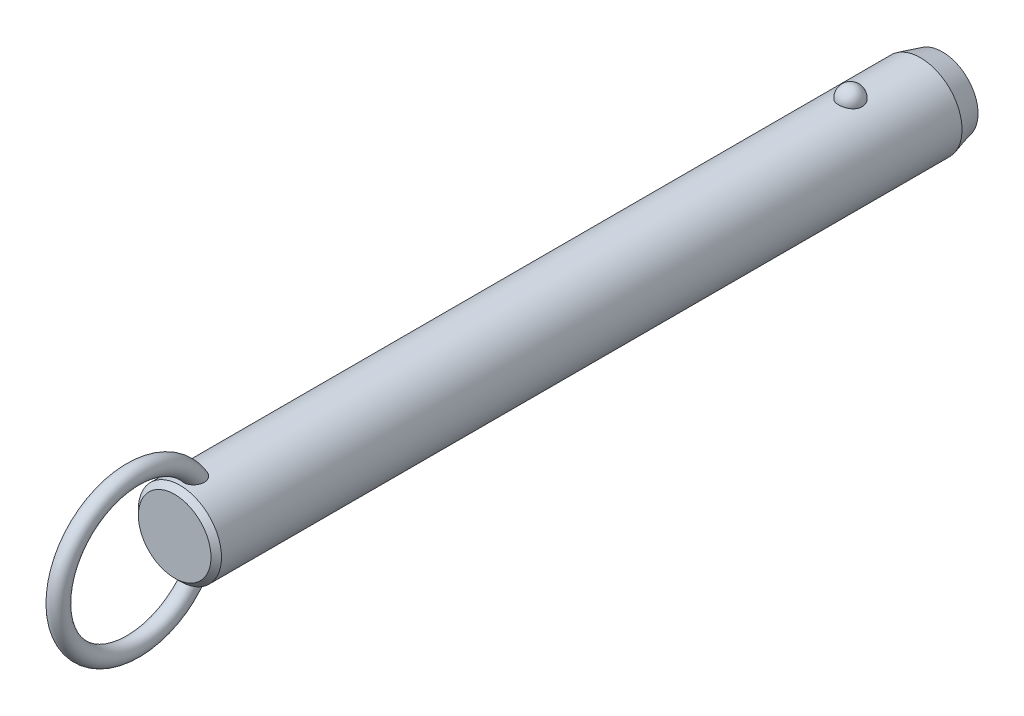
SolidWorks part; units mm, degrees
ref_plane "Front Plane" through (0, 0, 0) normal (0, 0, 1) x (1, 0, 0)
ref_plane "Top Plane" through (0, 0, 0) normal (0, 1, 0) x (1, 0, 0)
ref_plane "Right Plane" through (0, 0, 0) normal (1, 0, 0) x (0, 0, -1)
sketch "Sketch2" plane through (0, 0, 0) normal (0, 0, 1) x (1, 0, 0)
  circle A0 centre (0, 0) radius 9.5
  point P3 (0, 9.5)
  dimension "D1" = 19
extrude "Boss-Extrude1" add sketch "Sketch2" along normal blind 142.2
sketch "Sketch3" plane through (0, 0, 0) normal (0, 0, -1) x (-1, 0, 0)
  circle A0 centre (0, 0) radius 9.5
  dimension "D1" = 19
extrude "Boss-Extrude2" add sketch "Sketch3" along normal blind 23.7
chamfer "Chamfer1" distance 5 angle 15 1 edges at (-9.5, 0, -23.7)
sketch "Sketch12" plane through (0, 0, 0) normal (1, 0, 0) x (0, 0, -1)
  line L0 (-142.2, 9.5) -> (-142.2, -9.5) construction
  point P0 (-142.2, 0)
sketch "Sketch13" plane through (0, 0, 0) normal (1, 0, 0) x (0, 0, -1)
  circle A0 centre (-161.25, 0) radius 19.05
  point P2 (-142.2, 0)
  dimension "D1" = 38.1
sketch "Sketch14" plane through (0, 0, 0) normal (0, 1, 0) x (1, 0, 0)
  circle A0 centre (0, -144.2) radius 2
  point P2 (0, -142.2)
  dimension "D1" = 4
sweep "Sweep1" add profiles "Sketch14" path "Sketch13"
sketch "Sketch15" plane through (0, 0, 142.2) normal (0, 0, 1) x (1, 0, 0)
  circle A0 centre (0, 0) radius 9.5
  dimension "D1" = 19
extrude "Boss-Extrude3" add sketch "Sketch15" along normal blind 9.52
chamfer "Chamfer2" distance 1.2 angle 45 1 edges at (9.5, 0, 151.72)
sketch "Sketch18" plane through (0, 0, 0) normal (1, 0, 0) x (0, 0, -1)
  line L0 (18.7, 9.5) -> (-144.7378, 9.5) construction
  line L1 (2.7, 12.2) -> (2.7, 6.8)
  line L2 (-144.7378, -9.5) -> (18.7, -9.5) construction
  arc A0 (2.7, 12.2) -> (2.7, 6.8) centre (2.7, 9.5) ccw
  point P4 (0, 9.5)
  dimension "D1" = 21.7
revolve "Revolve1" add sketch "Sketch18" angle 360 about L1
